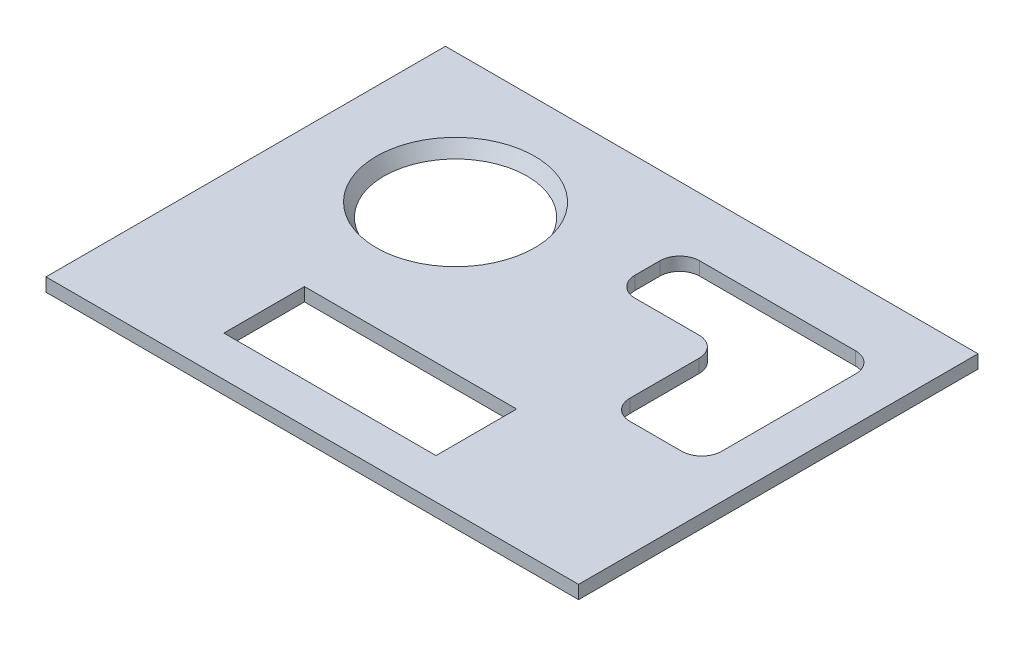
SolidWorks part; units mm, degrees
ref_plane "Front Plane" through (0, 0, 0) normal (0, 0, 1) x (1, 0, 0)
ref_plane "Top Plane" through (0, 0, 0) normal (0, 1, 0) x (1, 0, 0)
ref_plane "Right Plane" through (0, 0, 0) normal (1, 0, 0) x (0, 0, -1)
sketch "Sketch1" plane through (0, 0, 0) normal (0, 1, 0) x (1, 0, 0)
  line L1 (0, 0) -> (101.6, 0)
  line L2 (0, 0) -> (0, 76.2)
  line L3 (0, 76.2) -> (101.6, 76.2)
  line L4 (101.6, 0) -> (101.6, 76.2)
  dimension "D1" = 76.2
  dimension "D2" = 101.6
extrude "Extrude1" add sketch "Sketch1" along normal blind 2.54
sketch "Sketch2" plane through (0, 2.54, 0) normal (0, 1, 0) x (-1, 0, 0)
  line L0 (-93.2642, -61.2017) -> (-93.2642, -35.6414)
  line L1 (-89.4542, -31.8314) -> (-79.5446, -31.8314)
  line L2 (-75.7346, -35.6414) -> (-75.7346, -48.8574)
  line L3 (-71.9246, -52.6674) -> (-59.7056, -52.6674)
  line L4 (-55.8956, -56.4774) -> (-55.8956, -61.2017)
  line L5 (-59.7056, -65.0117) -> (-89.4542, -65.0117)
  arc A0 (-93.2642, -35.6414) -> (-89.4542, -31.8314) centre (-89.4542, -35.6414) cw
  arc A1 (-79.5446, -31.8314) -> (-75.7346, -35.6414) centre (-79.5446, -35.6414) cw
  arc A2 (-75.7346, -48.8574) -> (-71.9246, -52.6674) centre (-71.9246, -48.8574) ccw
  arc A3 (-59.7056, -52.6674) -> (-55.8956, -56.4774) centre (-59.7056, -56.4774) cw
  arc A4 (-55.8956, -61.2017) -> (-59.7056, -65.0117) centre (-59.7056, -61.2017) cw
  arc A5 (-93.2642, -61.2017) -> (-89.4542, -65.0117) centre (-89.4542, -61.2017) ccw
  dimension "D1" = 3.81
extrude "Cut-Extrude1" cut sketch "Sketch2" against normal blind 2.54
sketch "Sketch3" plane through (0, 2.54, 0) normal (0, 1, 0) x (-1, 0, 0)
  line L1 (-66.722, -23.0583) -> (-26.2486, -23.0583)
  line L2 (-66.722, -23.0583) -> (-66.722, -7.6803)
  line L3 (-66.722, -7.6803) -> (-26.2486, -7.6803)
  line L4 (-26.2486, -23.0583) -> (-26.2486, -7.6803)
extrude "Cut-Extrude2" cut sketch "Sketch3" against normal blind 2.54
sketch "Sketch4" plane through (0, 2.54, 0) normal (0, 1, 0) x (-1, 0, 0)
  circle A0 centre (-26.6952, -51.4356) radius 15.1163
extrude "Cut-Extrude3" cut sketch "Sketch4" against normal blind 2.54 draft 30
